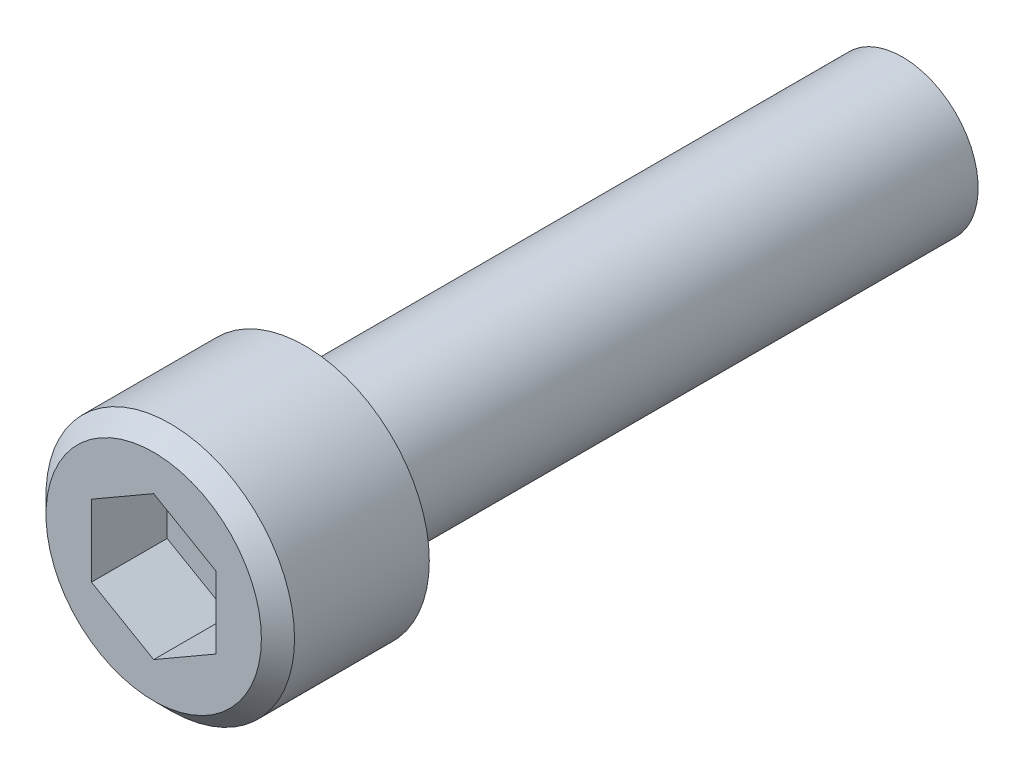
SolidWorks part; units mm, degrees
ref_plane "Plane1" through (0, 0, 0) normal (0, 0, 1) x (1, 0, 0)
ref_plane "Plane2" through (0, 0, 0) normal (0, 1, 0) x (1, 0, 0)
ref_plane "Plane3" through (0, 0, 0) normal (1, 0, 0) x (0, 0, -1)
sketch "Sketch1" plane through (0, 0, 0) normal (0, 0, 1) x (1, 0, 0)
  circle A0 centre (0, 0) radius 2.413
extrude "Shank" add sketch "Sketch1" along normal blind 19.05
sketch "Sketch2" plane through (0, 0, 19.05) normal (0, 0, 1) x (1, 0, 0)
  circle A0 centre (0, 0) radius 3.9624
extrude "Cap" add sketch "Sketch2" along normal blind 4.826
fillet "Fillet1" radius 0.3556 1 edges at (2.413, 0, 19.05)
sketch "Sketch3" plane through (4.8749, 0.9257, 23.876) normal (0, 0, 1) x (1, 0, 0)
  line L0 (-6.8592, 0.22) -> (-2.8905, 0.22) construction
  line L1 (-6.8592, 0.22) -> (-6.8592, -2.0714) construction
  line L2 (-2.8905, -2.0714) -> (-6.8592, -2.0714) construction
  line L3 (-2.8905, -2.0714) -> (-2.8905, 0.22) construction
  line L4 (-4.8749, 1.3657) -> (-2.8905, 0.22)
  line L5 (-2.8905, 0.22) -> (-2.8905, -2.0714)
  line L6 (-4.8749, -98.1422) -> (-4.8749, 85.7584) construction
  line L7 (-99.3531, -0.9257) -> (76.2591, -0.9257) construction
  line L8 (-6.8592, 0.22) -> (-6.8592, -2.0714)
  line L9 (-4.8749, 1.3657) -> (-6.8592, 0.22)
  line L10 (-4.8749, -3.2171) -> (-2.8905, -2.0714)
  line L11 (-4.8749, -3.2171) -> (-6.8592, -2.0714)
  circle A0 centre (-4.8749, -0.9257) radius 2.2914 construction
  point P14 (-2.8905, -0.9257)
  point P15 (-6.8592, -0.9257)
extrude "HexCut" cut sketch "Sketch3" against normal blind 2.413
chamfer "Chamfer1" distance 0.5283 angle 45 1 edges at (3.9624, 0, 23.876)
equation "\"HexDepth@HexCut\" = .5 * \"ThreadDia@Cap\""
equation "\"Cut@Chamfer1\" =  ( 1 / 15 )  * \"CapDia@Sketch2\""
